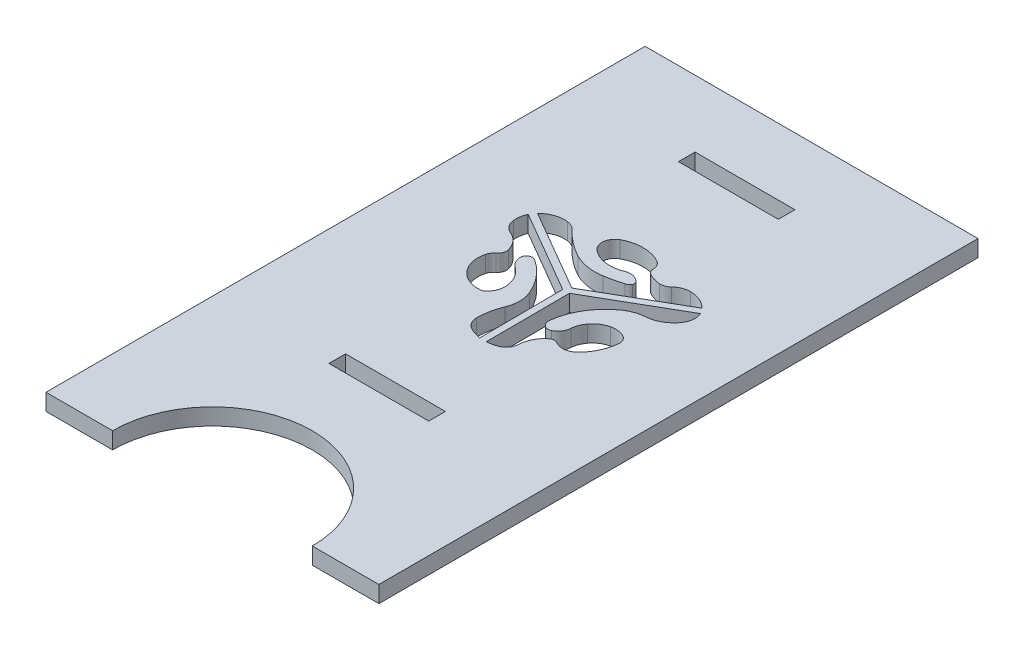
SolidWorks part; units mm, degrees
ref_plane "Alzado" through (0, 0, 0) normal (0, 0, 1) x (1, 0, 0)
ref_plane "Planta" through (0, 0, 0) normal (0, 1, 0) x (1, 0, 0)
ref_plane "Vista lateral" through (0, 0, 0) normal (1, 0, 0) x (0, 0, -1)
sketch "Croquis1" plane through (0, 0, 0) normal (0, 1, 0) x (1, 0, 0)
  line L1 (365.5164, -130.9064) -> (385.5164, -130.9064)
  line L8 (320.5164, -80.9064) -> (350.5164, -80.9064)
  line L9 (285.5164, -130.9064) -> (305.5164, -130.9064)
  line L10 (285.5164, -130.9064) -> (285.5164, 49.0936)
  line L11 (285.5164, 49.0936) -> (385.5164, 49.0936)
  line L12 (385.5164, -130.9064) -> (385.5164, 49.0936)
  line L13 (350.5164, -80.9064) -> (350.5164, -75.9064)
  line L14 (350.5164, -75.9064) -> (320.5164, -75.9064)
  line L15 (320.5164, -75.9064) -> (320.5164, -80.9064)
  line L17 (320.5164, 24.0936) -> (320.5164, 29.0936)
  line L18 (350.5164, 24.0936) -> (320.5164, 24.0936)
  line L19 (350.5164, 29.0936) -> (350.5164, 24.0936)
  line L20 (320.5164, 29.0936) -> (350.5164, 29.0936)
  arc A0 (305.5164, -130.9064) -> (365.5164, -130.9064) centre (335.5164, -130.9064) cw
  point P0 (-30.909, -85.6617)
  point P1 (-30.909, 14.3383)
  point P2 (39.8017, 85.049)
  point P3 (210.5124, 14.3383)
  point P4 (139.8017, 85.049)
  point P6 (210.5124, -85.6617)
  point P7 (139.8017, -156.3724)
  point P8 (39.8017, -156.3724)
  point P14 (-35.909, -85.6617)
  point P17 (-35.909, 16.4093)
  point P22 (37.7306, 90.049)
  point P23 (141.8728, 90.049)
  point P24 (214.0479, 17.8738)
  point P25 (214.0479, -89.1973)
  point P26 (141.8728, -161.3724)
  point P27 (37.7306, -161.3724)
  point P28 (-34.4445, -89.1973)
  point P29 (215.5124, 14.3383)
  point P30 (215.5124, -85.6617)
  point P36 (-30.909, -20.6617)
  point P37 (210.5124, -20.6617)
  point P38 (210.5124, -50.6617)
  point P39 (-30.909, -50.6617)
  point P40 (164.5504, -131.6237)
  point P41 (-6.1602, 39.087)
  point P42 (15.053, 60.3002)
  point P43 (185.7636, -110.4105)
  dimension "D6" = 20
  dimension "D7" = 5
  dimension "D8" = 100
  dimension "D14" = 100
  dimension "D15" = 5
  dimension "D16" = 180
  dimension "D17" = 35
  dimension "D18" = 35
extrude "Saliente-Extruir1" add sketch "Croquis1" along normal blind 5
sketch "Croquis3" plane through (0, 5, 0) normal (0, 1, 0) x (1, 0, 0)
  line L0 (-181.3375, 41.5278) -> (330.6625, 41.5278) construction
sketch "Croquis4" plane through (0, 5, 0) normal (0, 1, 0) x (1, 0, 0)
  line L0 (312.827, -10.5431) -> (312.9525, -10.4176)
  line L4 (311.6333, -12.1627) -> (336.38, -26.5346)
  line L5 (338.38, -26.533) -> (363.3445, -12.1321)
  line L6 (336.38, -26.5346) -> (336.513, -51.5761)
  line L7 (312.827, -10.5431) -> (337.3786, -24.8017)
  line L8 (337.3786, -24.8017) -> (362.174, -10.4984)
  line L9 (338.38, -26.533) -> (338.5133, -51.6308)
  arc A0 (312.9525, -10.4176) -> (319.4048, -8.1717) centre (318.5006, -15.9657) cw
  arc A1 (319.4048, -8.1717) -> (322.3967, -9.6953) centre (318.849, -12.9628) cw
  arc A2 (322.3967, -9.6953) -> (329.8964, -15.4851) centre (343.1074, 9.3793) ccw
  arc A3 (329.8964, -15.4851) -> (338.8324, -16.9576) centre (336.5487, -2.9648) ccw
  arc A4 (338.8324, -16.9576) -> (344.3012, -15.7101) centre (331.5996, 27.36) ccw
  arc A5 (344.3012, -15.7101) -> (345.5559, -14.7051) centre (343.7011, -13.6751) ccw
  arc A6 (345.5559, -14.7051) -> (345.4205, -13.5537) centre (344.6885, -14.2234) ccw
  arc A7 (345.4205, -13.5537) -> (340.9136, -12.5492) centre (342.4491, -16.2723) ccw
  arc A8 (340.9136, -12.5492) -> (331.5996, -11.4247) centre (337.2587, -3.6869) cw
  arc A9 (331.5996, -11.4247) -> (332.0177, -4.9954) centre (333.8534, -8.343) cw
  arc A10 (332.0177, -4.9954) -> (343.1074, -4.9954) centre (337.5626, -15.1072) cw
  arc A11 (343.1074, -4.9954) -> (344.6885, -7.6657) centre (341.6431, -7.6657) cw
  arc A12 (344.6885, -7.6657) -> (345.6738, -9.3578) centre (346.6341, -7.6657) ccw
  arc A13 (345.6738, -9.3578) -> (349.3668, -10.5031) centre (350.1375, -1.4921) ccw
  arc A14 (349.3668, -10.5031) -> (352.0985, -9.5328) centre (349.6653, -7.0131) ccw
  arc A15 (352.0985, -9.5328) -> (356.1206, -7.9078) centre (356.1206, -13.698) cw
  arc A16 (356.1206, -7.9078) -> (362.174, -10.4984) centre (356.1206, -16.2756) cw
  arc A17 (363.3445, -12.1321) -> (363.0482, -16.9576) centre (358.8043, -14.2752) cw
  arc A18 (363.0482, -16.9576) -> (355.8932, -21.2206) centre (355.2725, -12.043) cw
  arc A19 (355.8932, -21.2206) -> (350.7051, -23.016) centre (356.5987, -31.653) ccw
  arc A20 (350.7051, -23.016) -> (342.4491, -36.5543) centre (361.5578, -38.9207) ccw
  arc A21 (342.4491, -36.5543) -> (343.7011, -38.9207) centre (344.7686, -36.8415) ccw
  arc A22 (343.7011, -38.9207) -> (345.4205, -38.9207) centre (344.5608, -37.2463) ccw
  arc A23 (345.4205, -38.9207) -> (347.7277, -35.442) centre (343.4705, -35.1229) ccw
  arc A24 (347.7277, -35.442) -> (349.0959, -31.8114) centre (354.595, -35.9568) cw
  arc A25 (349.0959, -31.8114) -> (353.2837, -29.0593) centre (355.0373, -36.2902) cw
  arc A26 (353.2837, -29.0593) -> (357.5623, -29.6324) centre (354.6866, -34.844) cw
  arc A27 (357.5623, -29.6324) -> (358.8947, -32.0952) centre (356.3101, -31.9017) cw
  arc A28 (358.8947, -32.0952) -> (355.0373, -40.5416) centre (345.5272, -31.0944) cw
  arc A29 (355.0373, -40.5416) -> (349.3668, -41.267) centre (351.7361, -37.2622) cw
  arc A30 (349.3668, -41.267) -> (347.1793, -41.4082) centre (348.3765, -42.941) ccw
  arc A31 (347.1793, -41.4082) -> (344.0654, -47.4279) centre (352.1793, -47.8098) ccw
  arc A32 (344.0654, -47.4279) -> (341.5863, -50.9202) centre (340.1034, -47.2414) cw
  arc A33 (341.5863, -50.9202) -> (338.5133, -51.6308) centre (337.7895, -41.5011) cw
  arc A34 (333.0095, -50.4613) -> (330.8243, -46.8189) centre (334.9527, -46.8189) cw
  arc A35 (330.8243, -46.8189) -> (332.2402, -39.7149) centre (349.3533, -46.8189) cw
  arc A36 (332.2402, -39.7149) -> (332.2402, -32.3971) centre (323.426, -36.056) ccw
  arc A37 (332.2402, -32.3971) -> (324.4053, -23.016) centre (313.2851, -40.2657) ccw
  arc A38 (324.4053, -23.016) -> (321.6684, -24.5079) centre (323.4435, -24.5079) ccw
  arc A39 (321.6684, -24.5079) -> (323.3996, -27.8303) centre (325.7219, -24.5079) ccw
  arc A40 (323.3996, -27.8303) -> (327.0001, -34.0421) centre (318.5237, -34.8059) cw
  arc A41 (327.0001, -34.0421) -> (326.0928, -37.5315) centre (321.6804, -34.5215) cw
  arc A42 (326.0928, -37.5315) -> (325.5318, -38.2851) centre (316.6716, -31.1045) cw
  arc A43 (325.5318, -38.2851) -> (324.2139, -38.9999) centre (324.0102, -37.0519) cw
  arc A44 (324.2139, -38.9999) -> (315.6376, -29.0593) centre (323.3822, -31.0475) cw
  arc A45 (315.6376, -29.0593) -> (316.9532, -27.0807) centre (319.1329, -29.9567) cw
  arc A46 (316.9532, -27.0807) -> (317.8918, -24.3525) centre (315.3891, -25.017) ccw
  arc A47 (317.8918, -24.3525) -> (313.7562, -19.6218) centre (311.0362, -26.1727) ccw
  arc A48 (313.7562, -19.6218) -> (311.0362, -15.9657) centre (315.4624, -15.5125) cw
  arc A49 (311.0362, -15.9657) -> (311.6333, -12.1627) centre (318.5476, -15.1967) cw
  arc A50 (336.513, -51.5761) -> (333.0095, -50.4613) centre (337.7895, -41.5011) cw
extrude "Cortar-Extruir2" cut sketch "Croquis4" against normal blind 5
